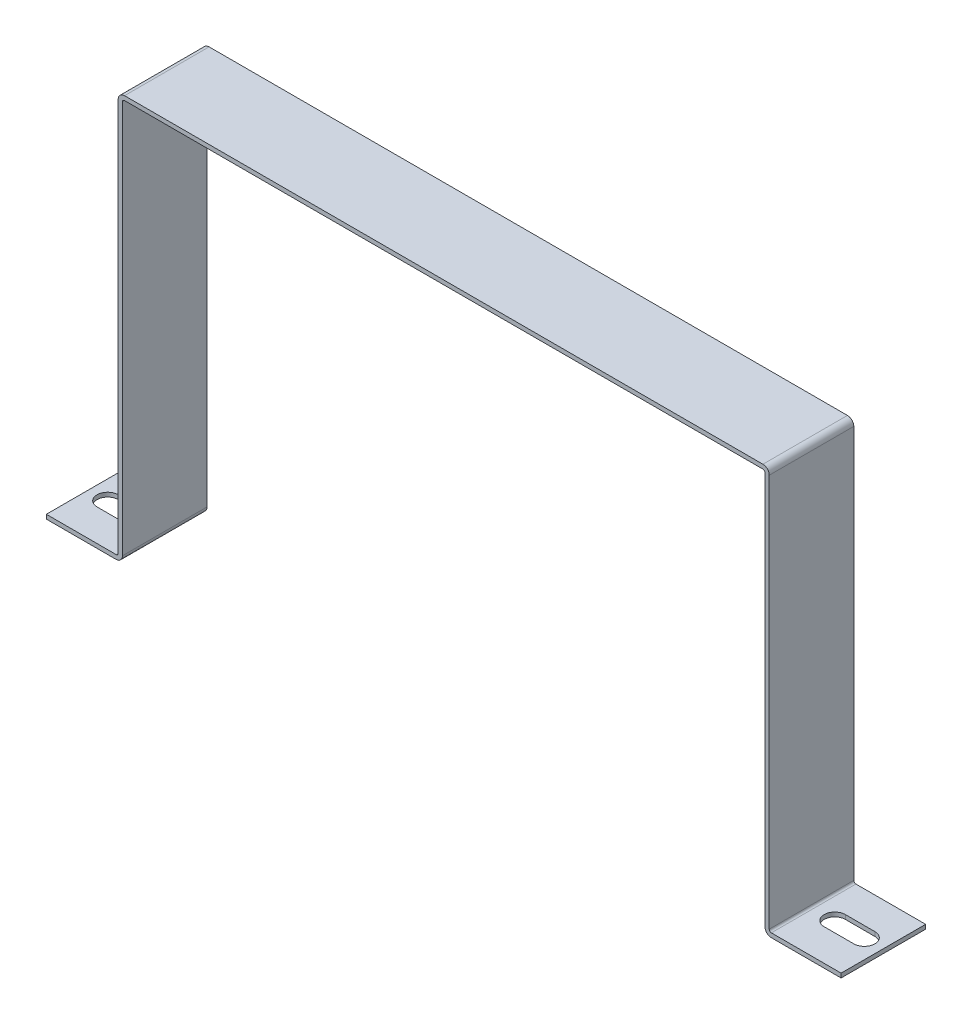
SolidWorks part; units mm, degrees
ref_plane "Plan de face" through (0, 0, 0) normal (0, 0, 1) x (1, 0, 0)
ref_plane "Plan de dessus" through (0, 0, 0) normal (0, 1, 0) x (1, 0, 0)
ref_plane "Plan de droite" through (0, 0, 0) normal (1, 0, 0) x (0, 0, -1)
sketch "Esquisse1" plane through (0, 0, 0) normal (0, 0, 1) x (1, 0, 0)
  line L0 (0, 0) -> (0, 91.0114) construction
  line L1 (75.5, 95) -> (-75.5, 95)
  line L2 (-76, 94.5) -> (-76, 1.5)
  line L3 (-77.5, 0) -> (-94, 0)
  line L4 (75.5, 96) -> (-75.5, 96)
  line L5 (-77, 94.5) -> (-77, 1.5)
  line L6 (-77.5, 1) -> (-94, 1)
  line L7 (-94, 1) -> (-94, 0)
  line L8 (0, 95) -> (-76, 95) construction
  line L9 (-76, 95) -> (-76, 0) construction
  line L10 (-77, 96) -> (-77, 1) construction
  line L11 (-77, 1) -> (-94, 1) construction
  line L12 (-76, 0) -> (-94, 0) construction
  line L13 (0, 96) -> (-77, 96) construction
  line L14 (94, 1) -> (94, 0)
  line L15 (77.5, 0) -> (94, 0)
  line L16 (77.5, 1) -> (94, 1)
  line L17 (76, 94.5) -> (76, 1.5)
  line L18 (77, 94.5) -> (77, 1.5)
  arc A0 (-75.5, 95) -> (-76, 94.5) centre (-75.5, 94.5) ccw
  arc A1 (-77, 1.5) -> (-77.5, 1) centre (-77.5, 1.5) cw
  arc A2 (-76, 1.5) -> (-77.5, 0) centre (-77.5, 1.5) cw
  arc A3 (-75.5, 96) -> (-77, 94.5) centre (-75.5, 94.5) ccw
  arc A4 (76, 1.5) -> (77.5, 0) centre (77.5, 1.5) ccw
  arc A5 (77, 1.5) -> (77.5, 1) centre (77.5, 1.5) ccw
  arc A6 (75.5, 96) -> (77, 94.5) centre (75.5, 94.5) cw
  arc A7 (75.5, 95) -> (76, 94.5) centre (75.5, 94.5) cw
  dimension "D5" = 0.5
  dimension "D6" = 1.5
  dimension "D1" = 152
  dimension "D2" = 95
  dimension "D3" = 18
extrude "Extrusion1" add sketch "Esquisse1" along normal blind 20
sketch "Esquisse2" plane through (0, 0, 0) normal (0, -1, 0) x (1, 0, 0)
  line L0 (-94, 10) -> (94, 10) construction
  line L1 (-94, 20) -> (-94, 0) construction
  line L2 (94, 20) -> (94, 0) construction
  line L3 (-89.5, 12.5) -> (-82.5, 12.5)
  line L4 (-89.5, 7.5) -> (-82.5, 7.5)
  line L5 (0, 0) -> (0, 28.1867) construction
  line L6 (89.5, 7.5) -> (82.5, 7.5)
  line L7 (89.5, 12.5) -> (82.5, 12.5)
  arc A0 (-89.5, 12.5) -> (-89.5, 7.5) centre (-89.5, 10) ccw
  arc A1 (-82.5, 7.5) -> (-82.5, 12.5) centre (-82.5, 10) ccw
  arc A2 (82.5, 7.5) -> (82.5, 12.5) centre (82.5, 10) cw
  arc A3 (89.5, 12.5) -> (89.5, 7.5) centre (89.5, 10) cw
  dimension "D2" = 2.5
  dimension "D1" = 7
  dimension "D3" = 4.5
extrude "Enlèv. mat.-Extru.1" cut sketch "Esquisse2" against normal through all
